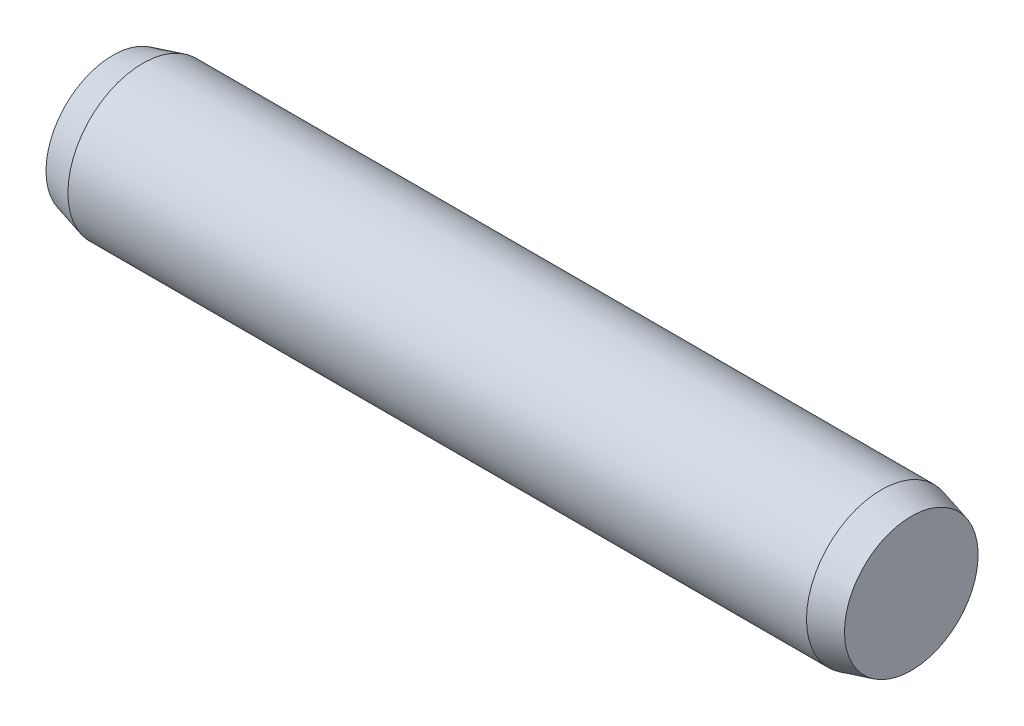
SolidWorks part; units mm, degrees
ref_plane "Plane1" through (0, 0, 0) normal (0, 0, 1) x (1, 0, 0)
ref_plane "Plane2" through (0, 0, 0) normal (0, 1, 0) x (1, 0, 0)
ref_plane "Plane3" through (0, 0, 0) normal (1, 0, 0) x (0, 0, -1)
sketch "Sketch1" plane through (0, 0, 0) normal (0, 0, 1) x (1, 0, 0)
  line L1 (-6.35, 0) -> (107.95, 0) construction
  line L2 (0, 0) -> (32, 0)
  line L3 (32, 0) -> (32, 2.6785)
  line L4 (32, 2.6785) -> (30.8, 3)
  line L5 (30.8, 3) -> (1.2, 3)
  line L6 (0, 2.6785) -> (0, 0)
  line L7 (0, 2.6785) -> (1.2, 3)
  dimension "D1" = 1.2
  dimension "D2" = 15
  dimension "D3" = 15
  dimension "Diameter" = 6
  dimension "Length" = 32
  dimension "Chamfer_len" = 1.2
revolve "Base-Revolve" add sketch "Sketch1" angle 360 about L1
equation "\"D3@Sketch1\" = 15.0"
equation "\"D1@Sketch1\" = \"Chamfer_len@Sketch1\""
equation "\"D2@Sketch1\" = \"D3@Sketch1\""
